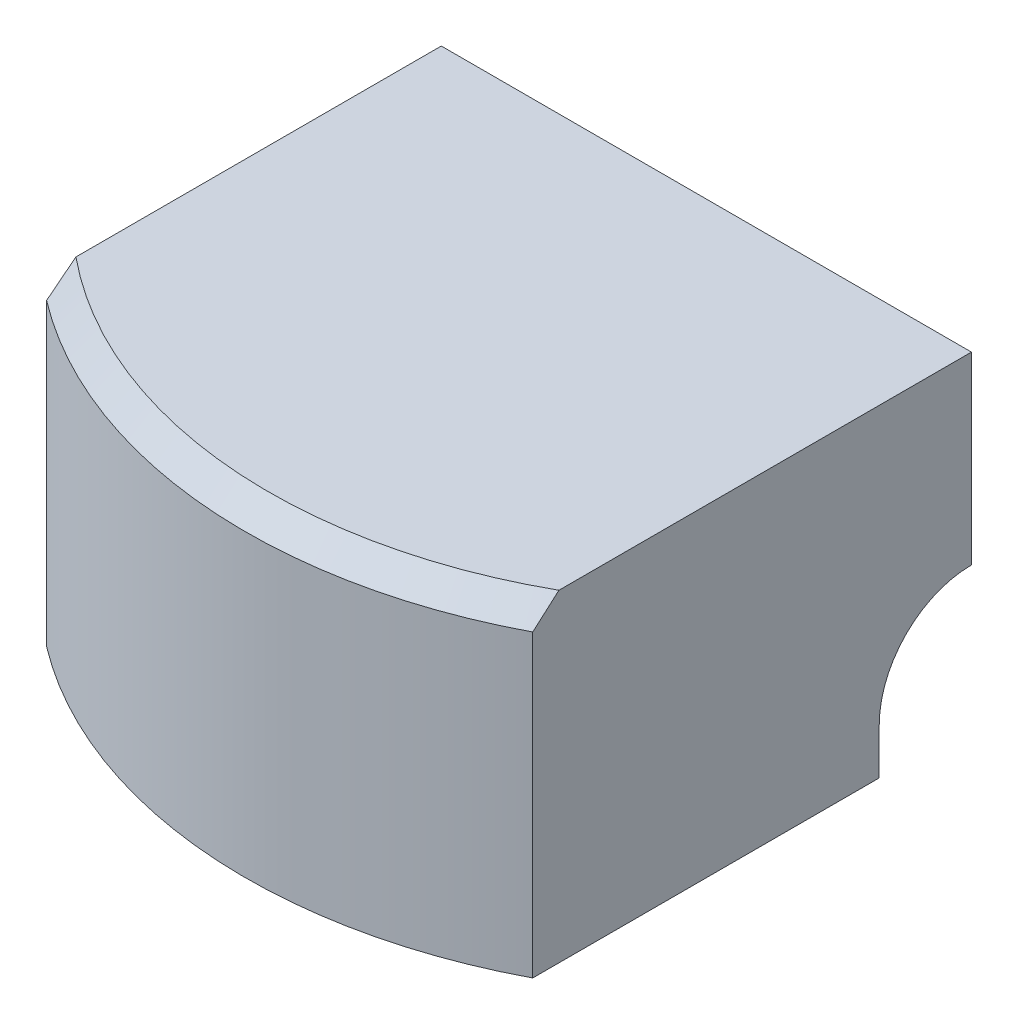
SolidWorks part; units mm, degrees
ref_plane "Front Plane" through (0, 0, 0) normal (0, 0, 1) x (1, 0, 0)
ref_plane "Top Plane" through (0, 0, 0) normal (0, 1, 0) x (1, 0, 0)
ref_plane "Right Plane" through (0, 0, 0) normal (1, 0, 0) x (0, 0, -1)
sketch "Sketch1" plane through (0, 0, 0) normal (0, 0, 1) x (1, 0, 0)
  line L0 (0, 0) -> (0, 121.5818) construction
  line L1 (-25.4, 0) -> (-136.525, 0)
  line L2 (0, 38.1) -> (0, 88.9)
  line L3 (0, 88.9) -> (-130.175, 88.9)
  line L4 (-25.4, 0) -> (-25.4, 12.7)
  line L5 (-136.525, 0) -> (-136.525, 82.55)
  line L6 (-136.525, 82.55) -> (-130.175, 88.9)
  arc A0 (0, 38.1) -> (-25.4, 12.7) centre (0, 12.7) ccw
  dimension "D1" = 45
  dimension "D3" = 25.4
  dimension "D2" = 88.9
  dimension "D4" = 273.05
  dimension "D5" = 38.1
  dimension "D6" = 6.35
revolve "Revolve1" add sketch "Sketch1" angle 180 about L0
sketch "Sketch2" plane through (0, 88.9, 0) normal (0, 1, 0) x (1, 0, 0)
  line L1 (63.5, 0) -> (136.7607, 0)
  line L2 (63.5, 0) -> (63.5, -169.9971)
  line L3 (63.5, -169.9971) -> (136.7607, -169.9971)
  line L4 (136.7607, 0) -> (136.7607, -169.9971)
  line L5 (63.5, 0) -> (0, 0) construction
  line L6 (-82.55, 0) -> (-82.55, -169.9971)
  line L7 (0, 0) -> (-130.175, 0) construction
  line L8 (-82.55, -169.9971) -> (-155.013, -169.9971)
  line L9 (-155.013, -169.9971) -> (-155.013, 0)
  line L10 (-155.013, 0) -> (-82.55, 0)
  dimension "D1" = 63.5
  dimension "D2" = 82.55
extrude "Cut-Extrude1" cut sketch "Sketch2" against normal through all
sketch "Sketch3" plane through (63.5, 0, 0) normal (1, 0, 0) x (0, 0, -1)
  line L0 (0, 0) -> (0, 88.9) construction
  line L1 (0, 0) -> (-120.8587, 0) construction
  line L2 (-25.4, 12.7) -> (-25.4, 0)
  line L3 (-25.4, 0) -> (0, 0)
  line L4 (0, 0) -> (0, 38.1)
  arc A0 (0, 38.1) -> (-25.4, 12.7) centre (0, 12.7) ccw
  dimension "D1" = 50.8
  dimension "D2" = 38.1
extrude "Cut-Extrude2" cut sketch "Sketch3" against normal up to surface (63.5 mm away)
